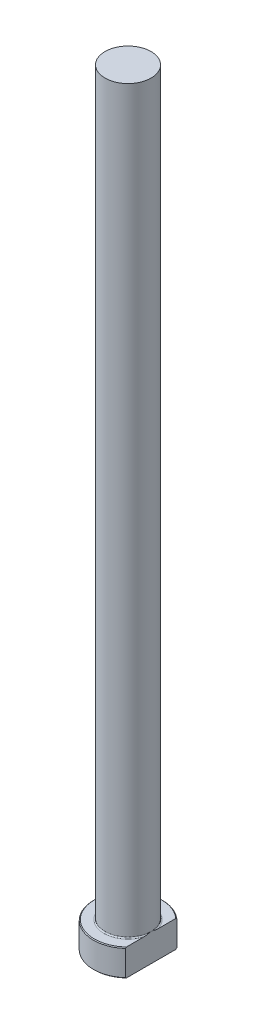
SolidWorks part; units mm, degrees
ref_plane "Front Plane" through (0, 0, 0) normal (0, 0, 1) x (1, 0, 0)
ref_plane "Top Plane" through (0, 0, 0) normal (0, 1, 0) x (1, 0, 0)
ref_plane "Right Plane" through (0, 0, 0) normal (1, 0, 0) x (0, 0, -1)
sketch "Sketch1" plane through (0, 0, 0) normal (0, 0, 1) x (1, 0, 0)
  line L0 (0, 259.9588) -> (0, -15.1925) construction
  line L1 (0, 0) -> (-9, 0)
  line L2 (-9, 0) -> (-9, 7)
  line L3 (-9, 7) -> (-6, 7)
  line L4 (-6, 7) -> (-6, 200)
  line L5 (-6, 200) -> (0, 200)
  line L6 (0, 200) -> (0, 0)
  dimension "L" = 200
  dimension "H" = 18
  dimension "T" = 7
  dimension "D" = 12
revolve "Revolve1" add sketch "Sketch1" angle 360 about L0
chamfer "Chamfer1" distance 0.2 angle 45 2 edges at (0, 7, 9) (0, 0, 9)
fillet "Fillet1" radius 0.3 1 edges at (0, 7, 6)
sketch "Sketch2" plane through (0, 0, 0) normal (0, 1, 0) x (1, 0, 0)
  line L0 (6, 6.7082) -> (6, -6.7082)
  circle A0 centre (0, 0) radius 9 construction
  arc A1 (6, -6.7082) -> (6, 6.7082) centre (0, 0) ccw
  circle A2 centre (0, 0) radius 6 construction
extrude "KEY" cut sketch "Sketch2" along normal through all
